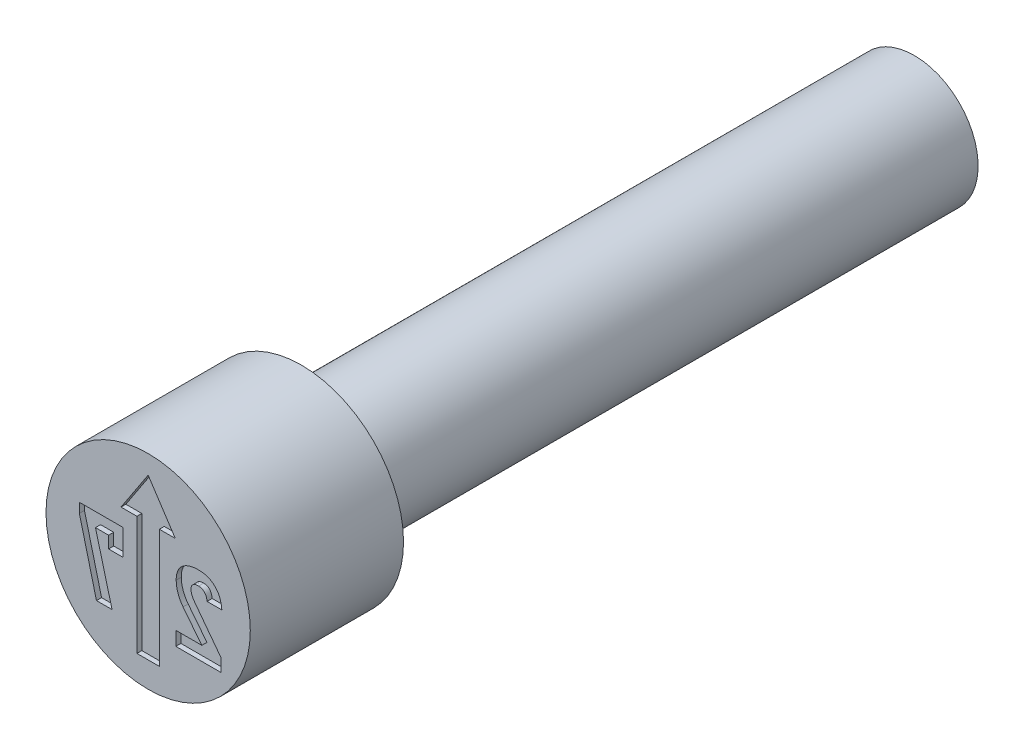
SolidWorks part; units mm, degrees
ref_plane "Front Plane" through (0, 0, 0) normal (0, 0, 1) x (1, 0, 0)
ref_plane "Top Plane" through (0, 0, 0) normal (0, 1, 0) x (1, 0, 0)
ref_plane "Right Plane" through (0, 0, 0) normal (1, 0, 0) x (0, 0, -1)
imported_body "Imported1"
sketch "Sketch1" plane through (0, 0, -0.3556) normal (0, 0, 1) x (1, 0, 0)
  line L7 (0.5321, 0.8255) -> (0, 1.6331)
  line L8 (0, 1.6331) -> (-0.5321, 0.8255)
  line L9 (-0.5321, 0.8255) -> (-0.22, 0.8255)
  line L10 (-0.22, 0.8255) -> (-0.22, -1.5)
  line L11 (-0.22, -1.5) -> (0.22, -1.5)
  line L12 (0.22, -1.5) -> (0.22, 0.8255)
  line L13 (0.22, 0.8255) -> (0.5321, 0.8255)
  line L14 (0.5321, 0.8255) -> (0, 1.6331)
  line L15 (0, 1.6331) -> (-0.5321, 0.8255)
  line L16 (-0.5321, 0.8255) -> (-0.22, 0.8255)
  line L17 (-0.22, 0.8255) -> (-0.22, -1.5)
  line L18 (-0.22, -1.5) -> (0.22, -1.5)
  line L19 (0.22, -1.5) -> (0.22, 0.8255)
  line L20 (0.22, 0.8255) -> (0.5321, 0.8255)
  dimension "D1" = 0
extrude "Boss-Extrude1" add sketch "Sketch1" along normal blind 0.26
sketch "Sketch2" plane through (0, 0, 0) normal (0, 0, 1) x (1, 0, 0)
  text T0 "2  7" font "Bahnschrift" height 1.5
  dimension "D2" = 1
extrude "Cut-Extrude1" cut sketch "Sketch2" against normal blind 0.1
